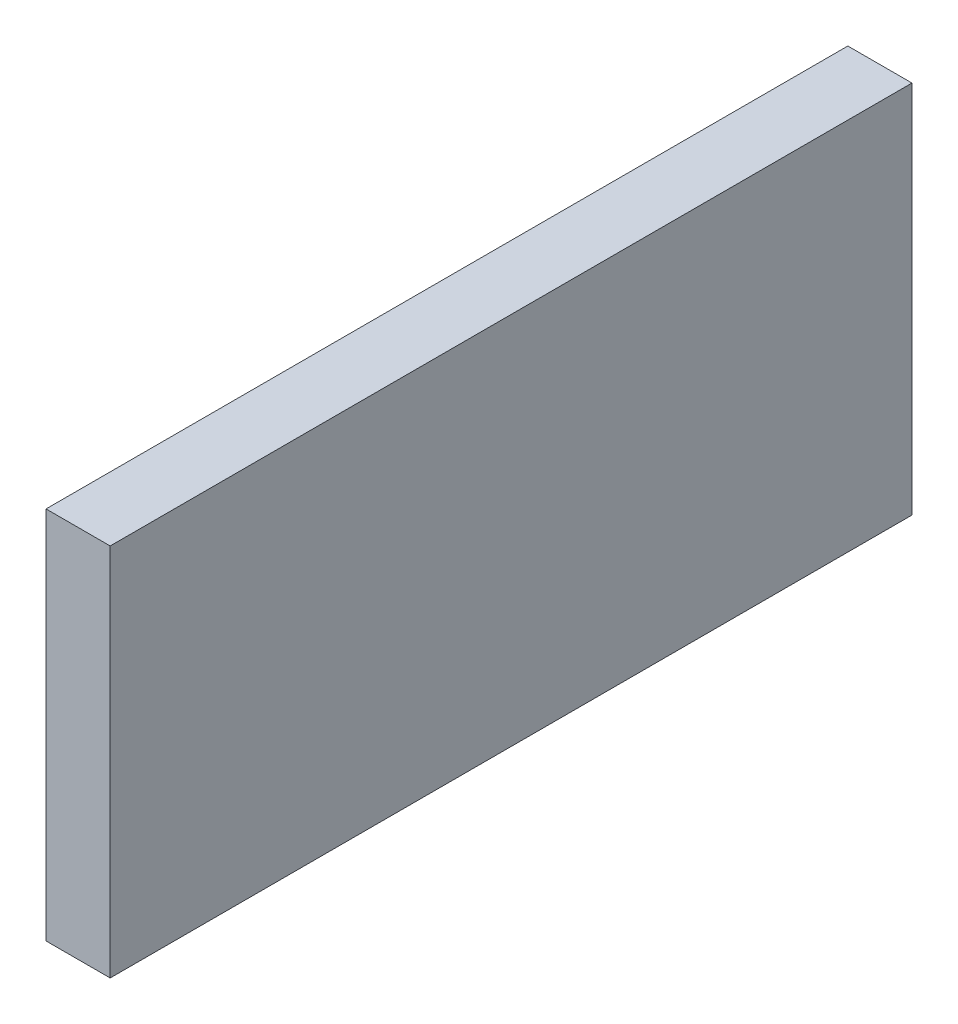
SolidWorks part; units mm, degrees
ref_plane "Front Plane" through (0, 0, 0) normal (0, 0, 1) x (1, 0, 0)
ref_plane "Top Plane" through (0, 0, 0) normal (0, 1, 0) x (1, 0, 0)
ref_plane "Right Plane" through (0, 0, 0) normal (1, 0, 0) x (0, 0, -1)
sketch "Sketch1" plane through (0, 0, 0) normal (1, 0, 0) x (0, 0, -1)
  line L1 (0, 0) -> (150, 0)
  line L2 (0, 0) -> (0, 70)
  line L3 (0, 70) -> (150, 70)
  line L4 (150, 0) -> (150, 70)
  dimension "D1" = 70
  dimension "D2" = 150
extrude "Boss-Extrude1" add sketch "Sketch1" along normal blind 12
